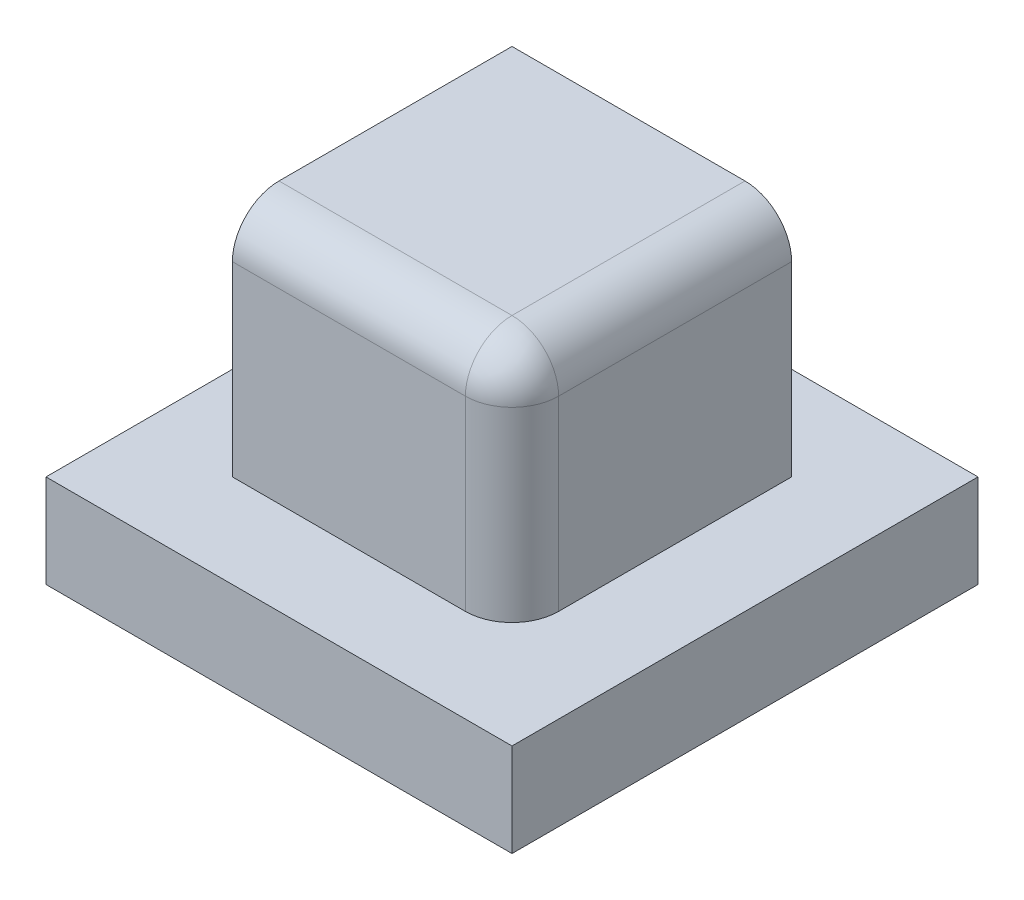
SolidWorks part; units mm, degrees
ref_plane "Front" through (0, 0, 0) normal (0, 0, 1) x (1, 0, 0)
ref_plane "Top" through (0, 0, 0) normal (0, 1, 0) x (1, 0, 0)
ref_plane "Right" through (0, 0, 0) normal (1, 0, 0) x (0, 0, -1)
sketch "Sketch1" plane through (0, 0, 0) normal (0, 0, 1) x (1, 0, 0)
  line L1 (-50, 20) -> (50, 20)
  line L2 (-50, 20) -> (-50, 0)
  line L3 (-50, 0) -> (50, 0)
  line L4 (50, 20) -> (50, 0)
  dimension "D1" = 20
  dimension "D2" = 100
extrude "Extrude1" add sketch "Sketch1" along normal mid plane 100
sketch "Sketch2" plane through (0, 20, 0) normal (0, 1, 0) x (-1, 0, 0)
  line L0 (30, -30) -> (-30, 30) construction
  line L1 (-30, 30) -> (30, 30)
  line L2 (-30, 30) -> (-30, -30)
  line L3 (-30, -30) -> (30, -30)
  line L4 (30, 30) -> (30, -30)
  dimension "D1" = 60
  dimension "D2" = 60
extrude "Extrude2" add sketch "Sketch2" along normal blind 50
fillet "Fillet1" radius 10 3 edges at (0, 70, 30) (30, 45, 30) (30, 70, 0)
